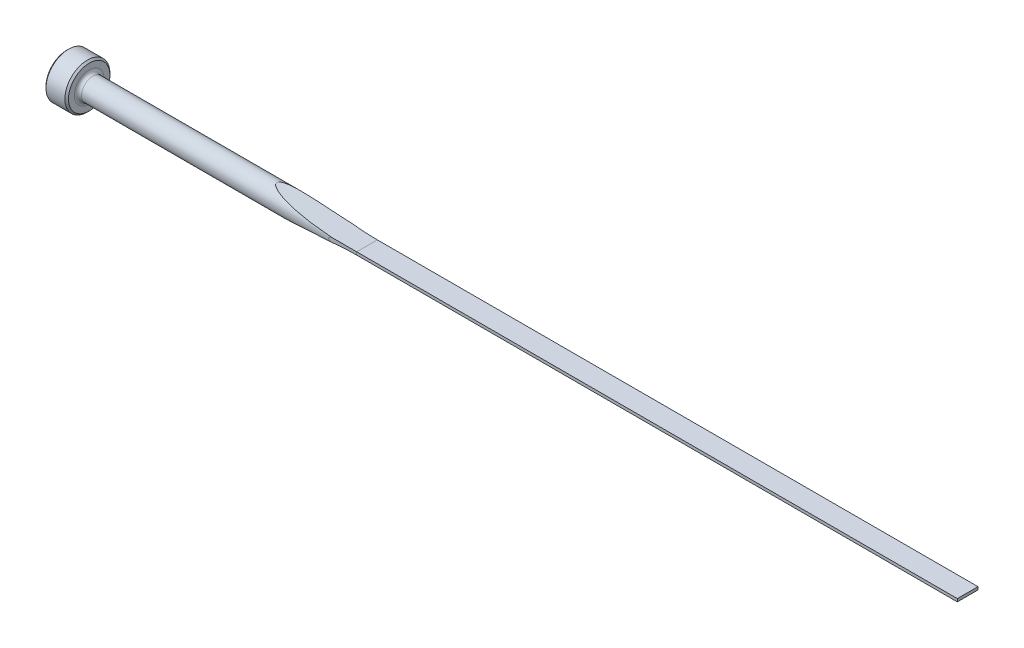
SolidWorks part; units mm, degrees
ref_plane "Front Plane" through (0, 0, 0) normal (0, 0, 1) x (1, 0, 0)
ref_plane "Top Plane" through (0, 0, 0) normal (0, 1, 0) x (1, 0, 0)
ref_plane "Right Plane" through (0, 0, 0) normal (1, 0, 0) x (0, 0, -1)
sketch "Sketch1" plane through (0, 0, 0) normal (0, 0, 1) x (1, 0, 0)
  line L0 (0, 0) -> (167.7268, 0) construction
  line L1 (0, 0) -> (0, 4.7625)
  line L2 (0, 4.7625) -> (4.7498, 4.7625)
  line L3 (4.7498, 4.7625) -> (4.7498, 2.3749)
  line L4 (4.7498, 2.3749) -> (190.5, 2.3749)
  line L5 (190.5, 2.3749) -> (190.5, 0)
  line L6 (190.5, 0) -> (0, 0)
  dimension "D1" = 190.5
  dimension "D2" = 9.525
  dimension "D3" = 4.7498
  dimension "D4" = 4.7498
revolve "Revolve1" add sketch "Sketch1" angle 360 about L0
sketch "Sketch2" plane through (0, 0, 0) normal (0, 0, 1) x (1, 0, 0)
  line L0 (190.5, 2.3749) -> (190.5, 0.3048)
  line L1 (190.5, -2.3749) -> (190.5, 2.3749) construction
  line L2 (190.5, 0.3048) -> (63.5, 0.3048)
  line L3 (190.5, 2.3749) -> (4.7498, 2.3749) construction
  line L4 (44.427, 2.3749) -> (190.5, 2.3749)
  line L5 (166.0833, 0) -> (153.1705, 0) construction
  arc A0 (63.5, 0.3048) -> (44.427, 2.3749) centre (63.5, 89.2048) cw
  dimension "D1" = 88.9
  dimension "D3" = 127
  dimension "D2" = 0.6096
  dimension "D4" = 19.073
extrude "Cut-Extrude1" cut sketch "Sketch2" against normal through all both and the other way through all
mirror "Mirror1" about plane through (0, 0, 0) normal (0, 1, 0) of "Cut-Extrude1"
sketch "Sketch3" plane through (0, 0, 0) normal (0, 1, 0) x (1, 0, 0)
  line L0 (190.5, 2.3749) -> (190.5, 2.1844)
  line L1 (190.5, 2.3553) -> (190.5, -2.3553) construction
  line L2 (190.5, 2.1844) -> (63.5, 2.1844)
  line L3 (190.5, 2.3749) -> (4.7498, 2.3749) construction
  line L4 (57.6832, 2.3749) -> (190.5, 2.3749)
  line L5 (163.4716, 0) -> (166.2513, 0) construction
  line L6 (63.5, 2.3553) -> (63.5, -2.3553) construction
  arc A0 (63.5, 2.1844) -> (57.6832, 2.3749) centre (63.5, 91.0844) cw
  dimension "D2" = 88.9
  dimension "D1" = 4.3688
extrude "Cut-Extrude2" cut sketch "Sketch3" against normal through all both and the other way through all
mirror "Mirror2" about plane through (0, 0, 0) normal (0, 0, 1) of "Cut-Extrude2"
fillet "Fillet1" radius 0.762 1 edges at (4.7498, 0, 2.3749)
chamfer "Chamfer1" distance 0.381 angle 45 2 edges at (0, 0, 4.7625) (4.7498, 0, 4.7625)
